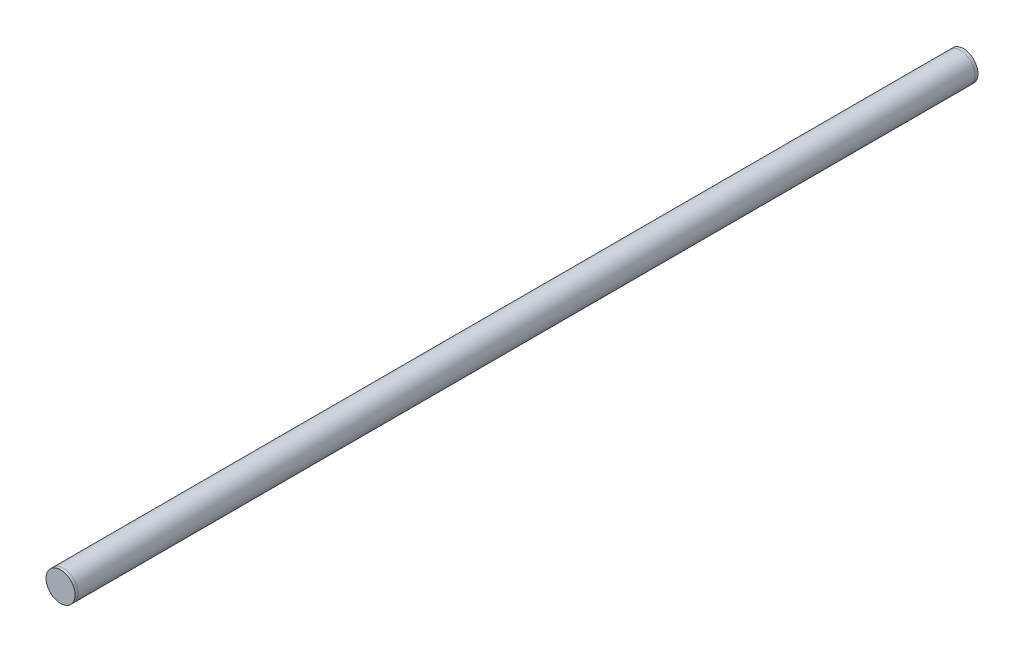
SolidWorks part; units mm, degrees
ref_plane "Front Plane" through (0, 0, 0) normal (0, 0, 1) x (1, 0, 0)
ref_plane "Top Plane" through (0, 0, 0) normal (0, 1, 0) x (1, 0, 0)
ref_plane "Right Plane" through (0, 0, 0) normal (1, 0, 0) x (0, 0, -1)
sketch "Sketch1" plane through (0, 0, 0) normal (0, 0, 1) x (1, 0, 0)
  circle A0 centre (0, 0) radius 12.7
  dimension "D1" = 25.4
extrude "Boss-Extrude1" add sketch "Sketch1" along normal blind 787.4
sketch "Sketch2" plane through (0, 0, 0) normal (1, 0, 0) x (0, 0, -1)
  line L0 (-2.54, 17.3003) -> (-2.54, -17.8005)
  line L1 (0, 13.97) -> (0, -13.97) construction
  line L2 (-784.86, 15.0437) -> (-784.86, -17.8005)
  line L3 (0, 12.7) -> (-787.4, 12.7) construction
  point P6 (-177.8, 12.7)
  point P7 (-508, 12.7)
  dimension "D1" = 2.54
  dimension "D2" = 2.54
  dimension "D3" = 177.8
  dimension "D4" = 508
ref_point "Point1"
ref_point "Point2"
